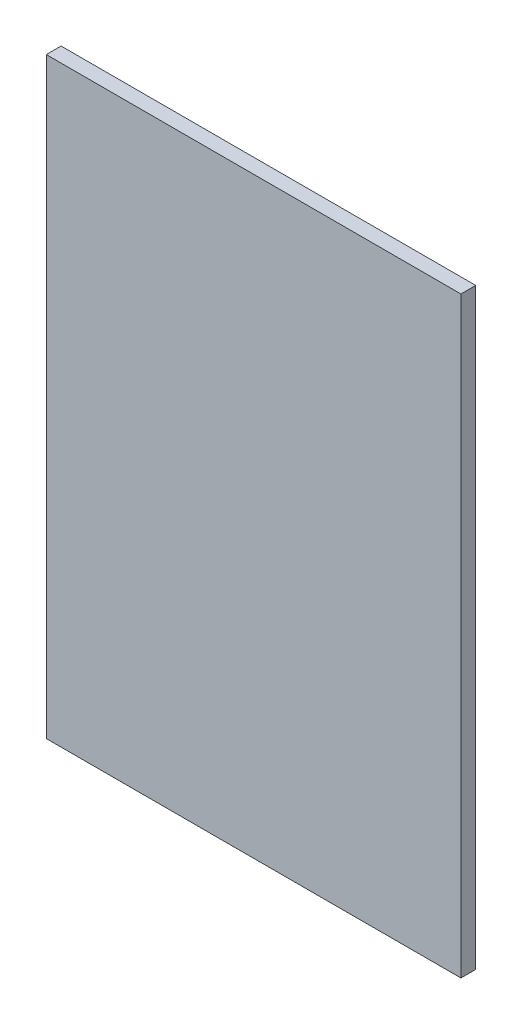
SolidWorks part; units mm, degrees
ref_plane "Front Plane" through (0, 0, 0) normal (1, 0, 0) x (0, 1, 0)
ref_plane "Top Plane" through (0, 0, 0) normal (0, 0, 1) x (0, 1, 0)
ref_plane "Right Plane" through (0, 0, 0) normal (0, 1, 0) x (-1, 0, 0)
sketch "Sketch1" plane through (0, 0, 0) normal (1, 0, 0) x (0, 1, 0)
  line L0 (-127, -6.35) -> (127, -6.35)
  line L1 (127, -6.35) -> (127, 0)
  line L2 (127, 0) -> (-127, 0)
  line L3 (-127, 0) -> (-127, -6.35)
extrude "Panel_or_block" add sketch "Sketch1" along normal blind 177.8
